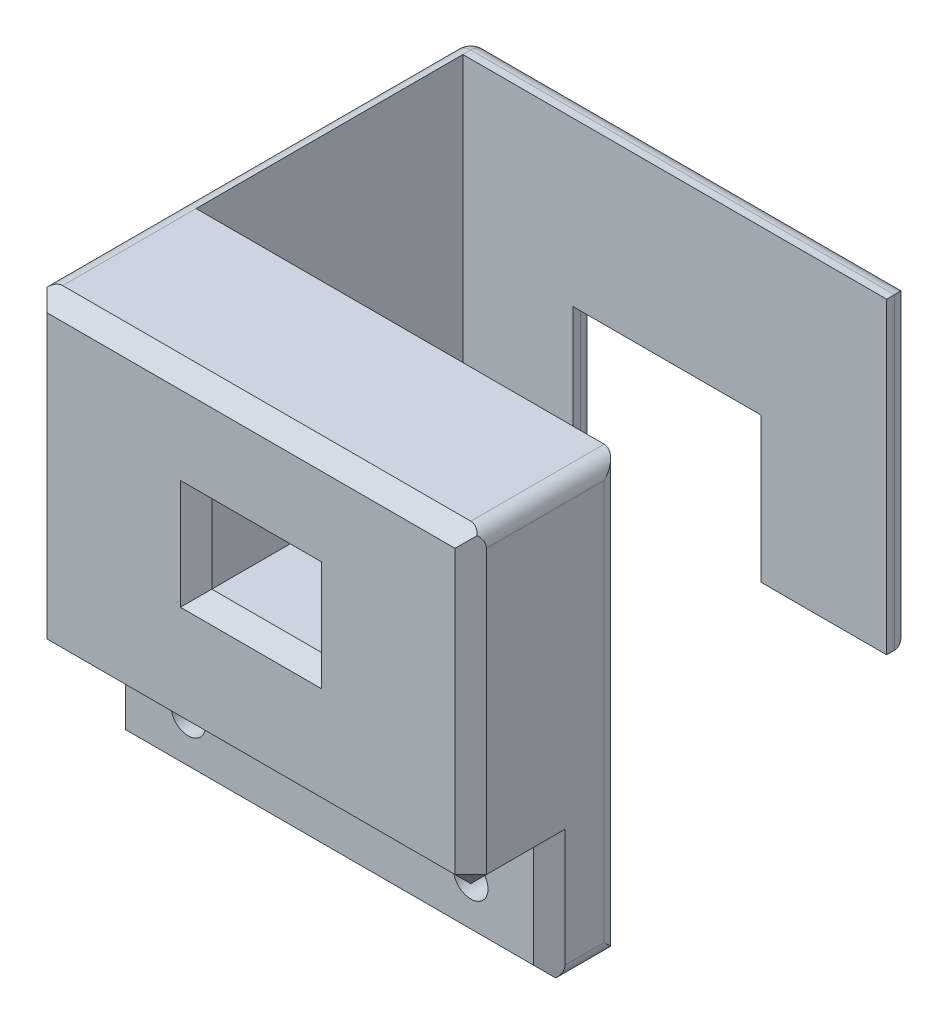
SolidWorks part; units mm, degrees
ref_plane "前视基准面" through (0, 0, 0) normal (0, 0, 1) x (1, 0, 0)
ref_plane "上视基准面" through (0, 0, 0) normal (0, 1, 0) x (1, 0, 0)
ref_plane "右视基准面" through (0, 0, 0) normal (1, 0, 0) x (0, 0, -1)
sketch "草图1" plane through (0, 0, 0) normal (0, 1, 0) x (1, 0, 0)
  line L1 (-14, -5) -> (14, -5)
  line L2 (-14, -5) -> (-14, 5)
  line L3 (-14, 5) -> (14, 5)
  line L4 (14, -5) -> (14, 5)
  line L5 (-14, -5) -> (14, 5) construction
  line L6 (-14, 5) -> (14, -5) construction
  point P0 (0, 0)
extrude "凸台-拉伸1" add sketch "草图1" along normal blind 27.5
sketch "草图2" plane through (0, 0, 0) normal (0, -1, 0) x (1, 0, 0)
  line L0 (14, 5) -> (14, -5) construction
  line L1 (-14, 5) -> (14, 5)
  line L2 (-14, 5) -> (-14, 0)
  line L3 (-14, 0) -> (14, 0)
  line L4 (14, 5) -> (14, 0)
extrude "切除-拉伸1" cut sketch "草图2" against normal blind 7.5
sketch "草图4" plane through (0, 0, -5) normal (0, 0, -1) x (-1, 0, 0)
  circle A0 centre (-9, 3.75) radius 2
  circle A1 centre (9, 3.75) radius 2
extrude "切除-拉伸2" cut sketch "草图4" against normal blind 2
sketch "草图5" plane through (0, 0, -3) normal (0, 0, -1) x (-1, 0, 0)
  circle A0 centre (-9, 3.75) radius 1.1
  circle A1 centre (9, 3.75) radius 1.1
extrude "切除-拉伸3" cut sketch "草图5" against normal blind 5
sketch "草图6" plane through (0, 0, 5) normal (0, 0, 1) x (1, 0, 0)
  line L0 (14, 7.5) -> (-14, 7.5) construction
  line L1 (-3.5, 15.5) -> (3.5, 15.5)
  line L2 (-3.5, 15.5) -> (-3.5, 20.5)
  line L3 (-3.5, 20.5) -> (3.5, 20.5)
  line L4 (3.5, 15.5) -> (3.5, 20.5)
  line L5 (-3.5, 15.5) -> (3.5, 20.5) construction
  line L6 (-3.5, 20.5) -> (3.5, 15.5) construction
  point P0 (0, 18)
  dimension "D1" = 8
  dimension "D2" = 7
  dimension "D3" = 5
extrude "切除-拉伸4" cut sketch "草图6" against normal blind 6
chamfer "倒角1" distance 1 angle 45 13 edges at (-3.5, 18, 5) (0, 20.5, 5) (3.5, 18, 5) (0, 15.5, 5) (-14, 7.5, 2.5) (-14, 3.75, 0) (14, 7.5, 2.5) (14, 3.75, 0) (-14, 17.5, 5) (14, 17.5, 5) (0, 27.5, 5) (0, 7.5, 5) (0, 0, 0)
sketch "草图8" plane through (0, 0, -5) normal (0, 0, -1) x (-1, 0, 0)
  line L4 (-14, 0) -> (14, 0) construction
  line L6 (14, 27.5) -> (14, 0) construction
  circle A2 centre (0, 12) radius 2.05
  dimension "D1" = 12
  dimension "D2" = 14
extrude "切除-拉伸5" cut sketch "草图8" against normal blind 5
sketch "草图9" plane through (0, 0, -5) normal (0, 0, -1) x (-1, 0, 0)
  line L1 (-14, 27.5) -> (14, 27.5)
  line L2 (-14, 27.5) -> (-14, 0)
  line L3 (-14, 0) -> (14, 0)
  line L4 (14, 27.5) -> (14, 0)
extrude "凸台-拉伸2" add sketch "草图9" along normal blind 18
sketch "草图10" plane through (14, 0, 0) normal (1, 0, 0) x (0, 0, -1)
  line L0 (-4, 27.5) -> (23, 27.5) construction
  line L1 (21.5, 27.5) -> (4.5, 27.5)
  line L2 (21.5, 27.5) -> (21.5, 0)
  line L3 (21.5, 0) -> (4.5, 0)
  line L4 (4.5, 27.5) -> (4.5, 0)
  line L5 (1, 0) -> (23, 0) construction
  line L6 (23, 27.5) -> (23, 0) construction
  dimension "D1" = 17
  dimension "D2" = 1.5
extrude "切除-拉伸6" cut sketch "草图10" against normal blind 27
sketch "草图12" plane through (0, 0, -23) normal (0, 0, -1) x (-1, 0, 0)
  line L1 (-14, 27.5) -> (-14, 0) construction
  line L4 (14, 0) -> (14, 27.5) construction
  line L6 (14, 0) -> (-14, 0)
  line L7 (-14, 0) -> (-14, 7.8755)
  line L17 (14, 7.8755) -> (14, 0)
  line L33 (6, 7.8755) -> (14, 7.8755)
  line L35 (-14, 7.8755) -> (-6, 7.8755)
  line L36 (-6, 7.8755) -> (-6, 17.1015)
  line L37 (6, 7.8755) -> (6, 17.1015)
  line L38 (6, 17.1015) -> (-6, 17.1015)
extrude "切除-拉伸7" cut sketch "草图12" against normal blind 3
fillet "圆角4" radius 1 18 edges at (14, 13.75, -4.5) (14, 17.6878, -23) (-14, 27.5, -9.5) (-14, 18, 4) (-14, 8.5, 1.5) (-14, 4.25, -1) (-14, 0, -10.5) (-14, 3.9378, -20) (-14, 17.6878, -23) (0, 27.5, -23) (14, 27.5, -0.25) (14, 0, -2.75) (-14, 7.8755, -21.5) (-10, 7.8755, -23) (-6, 12.4885, -23) (0, 17.1015, -23) (6, 12.4885, -23) (10, 7.8755, -23)
